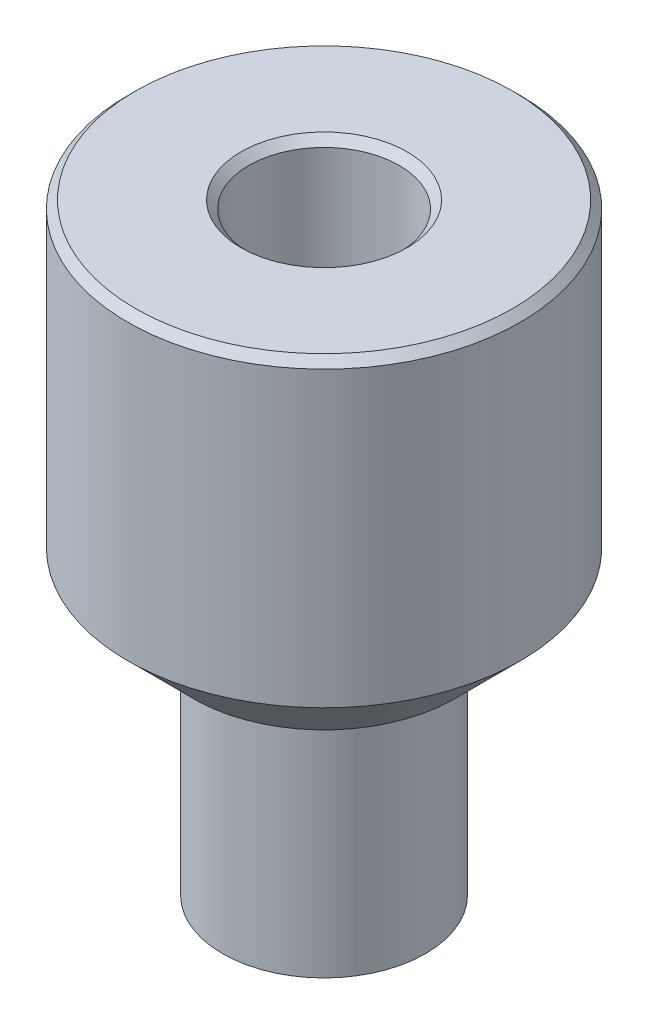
SolidWorks part; units mm, degrees
ref_plane "Plan de face" through (0, 0, 0) normal (0, 0, 1) x (1, 0, 0)
ref_plane "Plan de dessus" through (0, 0, 0) normal (0, 1, 0) x (1, 0, 0)
ref_plane "Plan de droite" through (0, 0, 0) normal (1, 0, 0) x (0, 0, -1)
sketch "Esquisse2" plane through (0, 0, 0) normal (0, 0, 1) x (1, 0, 0)
  line L0 (0, 0) -> (0, 22.7557) construction
  line L1 (-15, 46) -> (-5.75, 46)
  line L2 (-5.75, 46) -> (-5.75, 23.5)
  line L3 (-4.25, 22) -> (0, 22)
  line L4 (0, 22) -> (0, 0)
  line L5 (0, 0) -> (-7.75, 0)
  line L6 (-15, 23) -> (-15, 46)
  line L7 (-7.75, 0) -> (-7.75, 17.4)
  line L8 (-8.35, 18) -> (-10, 18)
  line L9 (-10, 18) -> (-15, 23)
  arc A0 (-5.75, 23.5) -> (-4.25, 22) centre (-4.25, 23.5) ccw
  arc A1 (-8.35, 18) -> (-7.75, 17.4) centre (-8.35, 17.4) cw
  point P13 (-15, 18)
  point P14 (-7.75, 18)
  dimension "D5" = 1.5
  dimension "D8" = 0.6
  dimension "D1" = 30
  dimension "D2" = 11.5
  dimension "D3" = 22
  dimension "D4" = 24
  dimension "D6" = 15.5
  dimension "D7" = 18
revolve "Révolution1" add sketch "Esquisse2" angle 360 about L0
sketch "Esquisse3" plane through (0, 0, 0) normal (0, -1, 0) x (1, 0, 0)
  line L0 (0, -2.5) -> (0, 2.5) construction
  line L1 (-1.6, -2.0494) -> (-1.6, 2.0494)
  line L2 (1.6, -2.0494) -> (1.6, 2.0494)
  arc A0 (1.6, 2.0494) -> (-1.6, 2.0494) centre (0, 0) ccw
  arc A2 (-1.6, -2.0494) -> (1.6, -2.0494) centre (0, 0) ccw
  point P2 (0, 0)
  dimension "D3" = 5.2
  dimension "D1" = 3.2
  dimension "D2" = 5
extrude "Enlèv. mat.-Extru.1" cut sketch "Esquisse3" against normal blind 8
chamfer "Chanfrein1" distance 0.6 angle 45 2 edges at (0, 46, -15) (0, 46, -5.75)
